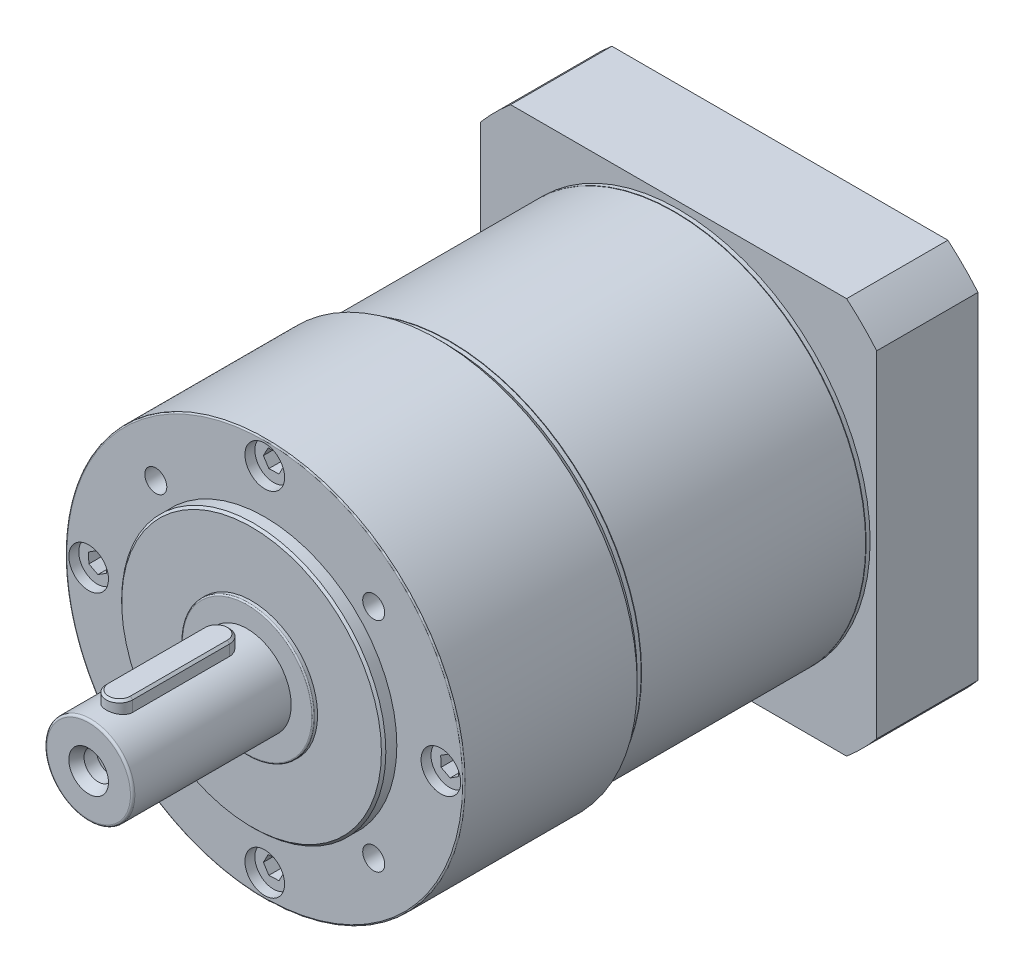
SolidWorks part; units mm, degrees
ref_plane "前视基准面" through (0, 0, 0) normal (0, 0, 1) x (1, 0, 0)
ref_plane "上视基准面" through (0, 0, 0) normal (0, 1, 0) x (1, 0, 0)
ref_plane "右视基准面" through (0, 0, 0) normal (1, 0, 0) x (0, 0, -1)
sketch "草图1" plane through (0, 0, 0) normal (0, 0, 1) x (1, 0, 0)
  circle A0 centre (0, 0) radius 45.25
extrude "凸台-拉伸1" add sketch "草图1" along normal blind 42
sketch "草图2" plane through (0, 0, 42) normal (0, 0, 1) x (1, 0, 0)
  circle A0 centre (0, 0) radius 30
extrude "凸台-拉伸2" add sketch "草图2" along normal blind 3
sketch "草图3" plane through (0, 0, 0) normal (0, 0, -1) x (-1, 0, 0)
  circle A0 centre (0, 0) radius 43.5
extrude "切除-拉伸1" cut sketch "草图3" against normal blind 1 flip side to cut
chamfer "倒角1" distance 1.65 angle 45 1 edges at (-45.25, 0, 1)
fillet "圆角1" radius 0.3 1 edges at (45.25, 0, 42)
ref_plane "基准面1" through (0, 0, -0.1) normal (0, 0, -1) x (-1, 0, 0)
sketch "草图4" plane through (0, 0, -0.1) normal (0, 0, -1) x (-1, 0, 0)
  circle A0 centre (0, 0) radius 43.5
extrude "凸台-拉伸3" add sketch "草图4" along normal blind 50.9 separate body
ref_plane "基准面2" through (0, 0, -51.1) normal (0, 0, -1) x (-1, 0, 0)
sketch "草图5" plane through (0, 0, -51.1) normal (0, 0, -1) x (-1, 0, 0)
  circle A0 centre (0, 0) radius 43.5
extrude "凸台-拉伸4" add sketch "草图5" along normal blind 0.9 separate body
sketch "草图6" plane through (0, 0, -52) normal (0, 0, -1) x (-1, 0, 0)
  line L1 (-38.1576, 45) -> (38.1576, 45)
  line L2 (-45, 38.1576) -> (-45, -38.1576)
  line L3 (-38.1576, -45) -> (38.1576, -45)
  line L4 (45, 38.1576) -> (45, -38.1576)
  arc A0 (-38.1576, 45) -> (-45, 38.1576) centre (0, 0) ccw
  arc A1 (-45, -38.1576) -> (-38.1576, -45) centre (0, 0) ccw
  arc A2 (38.1576, -45) -> (45, -38.1576) centre (0, 0) ccw
  arc A3 (45, 38.1576) -> (38.1576, 45) centre (0, 0) ccw
  dimension "D1" = 45
  dimension "D3" = 45
extrude "凸台-拉伸5" add sketch "草图6" along normal blind 23
sketch "草图7" plane through (0, 0, -75) normal (0, 0, -1) x (-1, 0, 0)
  circle A0 centre (0, 0) radius 35
extrude "切除-拉伸2" cut sketch "草图7" against normal blind 6
sketch "草图8" plane through (0, 0, -69) normal (0, 0, -1) x (-1, 0, 0)
  circle A0 centre (0, 0) radius 32
extrude "切除-拉伸3" cut sketch "草图8" against normal blind 20
sketch "草图9" plane through (0, 0, -75) normal (0, 0, -1) x (-1, 0, 0)
  line L0 (0, 0) -> (0, 40) construction
  line L1 (0, 0) -> (-13.6808, 37.5877) construction
  circle A0 centre (0, 0) radius 40 construction
  circle A1 centre (-13.6808, 37.5877) radius 4.5
  dimension "D1" = 20
extrude "切除-拉伸4" cut sketch "草图9" against normal blind 14
pattern_circular "阵列(圆周)1" count 4 over 360 about axis through (0, 0, 0) along (0, 0, 1) of "切除-拉伸4"
sketch "草图10" plane through (0, 0, -75) normal (0, 0, -1) x (-1, 0, 0)
  line L0 (0, 0) -> (-31.8198, 31.8198)
  circle A0 centre (0, 0) radius 45
hole_wizard "M5 螺纹孔1" positions "3D草图1" profile "草图11" tap size "M5" standard "GB"
sketch3d "3D草图1"
  point P0 (31.8198, 31.8198, -75)
sketch "草图11" plane through (31.8198, 31.8198, -75) normal (1, 0, 0) x (0, 1, 0)
  line L0 (0, 0) -> (0, 17.2618)
  line L1 (0, 17.2618) -> (2.1, 16)
  line L2 (2.1, 16) -> (2.1, 0)
  line L5 (2.1, 0) -> (0, 0)
  line L10 (0, 17.2618) -> (-2.1, 16) construction
  line L11 (0, -6.35) -> (0, 107.95) construction
  dimension "螺纹孔钻头直径" = 4.2
  dimension "螺纹孔钻头深度" = 16
  dimension "导头角度" = 118
pattern_circular "阵列(圆周)2" count 4 over 360 about axis through (0, 0, 0) along (0, 0, 1) of "M5 螺纹孔1"
sketch "草图12" plane through (0, 0, -61) normal (0, 0, -1) x (-1, 0, 0)
  line L1 (-12.6133, 39.6356) -> (-14.9205, 39.5362)
  line L2 (-14.9205, 39.5362) -> (-15.9881, 37.4883)
  line L3 (-15.9881, 37.4883) -> (-14.7484, 35.5399)
  line L4 (-14.7484, 35.5399) -> (-12.4411, 35.6393)
  line L5 (-12.4411, 35.6393) -> (-11.3735, 37.6871)
  line L6 (-11.3735, 37.6871) -> (-12.6133, 39.6356)
  circle A0 centre (-13.6808, 37.5877) radius 4.25
  circle A1 centre (-13.6808, 37.5877) radius 2 construction
  dimension "D1" = 4
extrude "凸台-拉伸6" add sketch "草图12" along normal blind 5
pattern_circular "阵列(圆周)3" count 4 over 360 about axis through (0, 0, 0) along (0, 0, 1) of "凸台-拉伸6"
sketch "草图13" plane through (0, 0, 42) normal (0, 0, 1) x (1, 0, 0)
  line L0 (0, 0) -> (0, -40) construction
  circle A0 centre (0, 0) radius 40 construction
  circle A1 centre (0, -40) radius 4.5
extrude "切除-拉伸5" cut sketch "草图13" against normal blind 7
pattern_circular "阵列(圆周)4" count 4 over 360 about axis through (0, 0, 0) along (0, 0, 1) of "切除-拉伸5"
sketch "草图14" plane through (0, 0, 35) normal (0, 0, 1) x (1, 0, 0)
  line L1 (1.0702, -37.9535) -> (-1.2372, -38.05)
  line L2 (-1.2372, -38.05) -> (-2.3074, -40.0965)
  line L3 (-2.3074, -40.0965) -> (-1.0702, -42.0465)
  line L4 (-1.0702, -42.0465) -> (1.2372, -41.95)
  line L5 (1.2372, -41.95) -> (2.3074, -39.9035)
  line L6 (2.3074, -39.9035) -> (1.0702, -37.9535)
  circle A0 centre (0, -40) radius 4.25
  circle A1 centre (0, -40) radius 2 construction
  dimension "D1" = 4
extrude "凸台-拉伸7" add sketch "草图14" along normal blind 5
pattern_circular "阵列(圆周)5" count 4 over 360 about axis through (0, 0, 0) along (0, 0, 1) of "凸台-拉伸7"
sketch "草图15" plane through (0, 0, 42) normal (0, 0, 1) x (1, 0, 0)
  line L0 (0, 0) -> (-24.7487, 24.7487)
  circle A0 centre (0, 0) radius 35
hole_wizard "M6 螺纹孔1" positions "3D草图2" profile "草图16" tap size "M6" standard "GB"
sketch3d "3D草图2"
  point P0 (-24.7487, 24.7487, 42)
sketch "草图16" plane through (-24.7487, 24.7487, 42) normal (1, 0, 0) x (0, -1, 0)
  line L0 (0, 0) -> (0, 18.5022)
  line L1 (0, 18.5022) -> (2.5, 17)
  line L2 (2.5, 17) -> (2.5, 0)
  line L5 (2.5, 0) -> (0, 0)
  line L10 (0, 18.5022) -> (-2.5, 17) construction
  line L11 (0, -6.35) -> (0, 107.95) construction
  dimension "螺纹孔钻头直径" = 5
  dimension "螺纹孔钻头深度" = 17
  dimension "导头角度" = 118
pattern_circular "阵列(圆周)6" count 4 over 360 about axis through (0, 0, 0) along (0, 0, 1) of "M6 螺纹孔1"
ref_plane "基准面3" through (0, 0, -68) normal (0, 0, -1) x (-1, 0, 0)
sketch "草图17" plane through (0, 0, -68) normal (0, 0, -1) x (-1, 0, 0)
  circle A0 centre (0, 0) radius 26
extrude "凸台-拉伸8" add sketch "草图17" against normal up to surface (19 mm away)
chamfer "倒角2" distance 1.5 angle 45 1 edges at (-26, 0, -68)
sketch "草图18" plane through (0, 0, -68) normal (0, 0, -1) x (-1, 0, 0)
  line L1 (-30.5825, 0.5) -> (30.8028, 0.5)
  line L2 (-30.5825, 0.5) -> (-30.5825, -0.5)
  line L3 (-30.5825, -0.5) -> (30.8028, -0.5)
  line L4 (30.8028, 0.5) -> (30.8028, -0.5)
  dimension "D1" = 0.5
  dimension "D2" = 1
extrude "切除-拉伸6" cut sketch "草图18" against normal up to surface (19 mm away)
sketch "草图19" plane through (0, 0, -75) normal (0, 0, -1) x (-1, 0, 0)
  circle A0 centre (0, 0) radius 9.5
extrude "切除-拉伸7" cut sketch "草图19" against normal blind 42
chamfer "倒角3" distance 0.5 angle 45 1 edges at (30, 0, 45)
sketch "草图20" plane through (0, 0, 45) normal (0, 0, 1) x (1, 0, 0)
  circle A0 centre (0, 0) radius 15
extrude "凸台-拉伸9" add sketch "草图20" along normal blind 1
fillet "圆角2" radius 0.3 1 edges at (15, 0, 46)
sketch "草图22" plane through (0, 0, 46) normal (0, 0, 1) x (1, 0, 0)
  circle A0 centre (0, 0) radius 10
extrude "凸台-拉伸10" add sketch "草图22" along normal blind 36
fillet "圆角3" radius 0.5 1 edges at (10, 0, 82)
sketch "草图23" plane through (0, 0, 0) normal (0, 1, 0) x (1, 0, 0)
  line L0 (-9.5, -82) -> (9.5, -82) construction
  line L1 (-3, -53) -> (-3, -75)
  line L2 (3, -53) -> (3, -75)
  arc A0 (-3, -75) -> (3, -75) centre (0, -75) ccw
  arc A1 (3, -53) -> (-3, -53) centre (0, -53) ccw
  dimension "D1" = 7
  dimension "D2" = 22
extrude "凸台-拉伸11" add sketch "草图23" along normal blind 12.5
chamfer "倒角4" distance 0.5 angle 45 4 edges at (-3, 12.5, 64) (0, 12.5, 78) (0, 12.5, 50) (3, 12.5, 64)
sketch "草图24" plane through (0, 0, 82) normal (0, 0, 1) x (1, 0, 0)
  circle A0 centre (0, 0) radius 3.25
extrude "切除-拉伸8" cut sketch "草图24" against normal blind 5
sketch "草图25" plane through (0, 0, 82) normal (0, 0, 1) x (1, 0, 0)
  circle A0 centre (0, 0) radius 4.5
ref_plane "基准面4" through (0, 0, 79.8) normal (0, 0, 1) x (1, 0, 0)
sketch "草图26" plane through (0, 0, 79.8) normal (0, 0, 1) x (1, 0, 0)
  circle A0 centre (0, 0) radius 3.25 construction
  circle A1 centre (0, 0) radius 3.25
loft "切除-放样1" cut profiles "草图26", "草图25"
hole_wizard "M6 螺纹孔2" positions "3D草图3" profile "草图27" tap size "M6" standard "GB"
sketch3d "3D草图3"
  line L0 (0, 0, 77) -> (0, 0, 79.8) construction
  point P0 (0, 0, 77)
sketch "草图27" plane through (0, 0, 77) normal (1, 0, 0) x (0, -1, 0)
  line L0 (0, 0) -> (0, 18.0022)
  line L1 (0, 18.0022) -> (2.5, 16.5)
  line L2 (2.5, 16.5) -> (2.5, 0)
  line L5 (2.5, 0) -> (0, 0)
  line L10 (0, 18.0022) -> (-2.5, 16.5) construction
  line L11 (0, -6.35) -> (0, 107.95) construction
  dimension "螺纹孔钻头直径" = 5
  dimension "螺纹孔钻头深度" = 16.5
  dimension "导头角度" = 118
